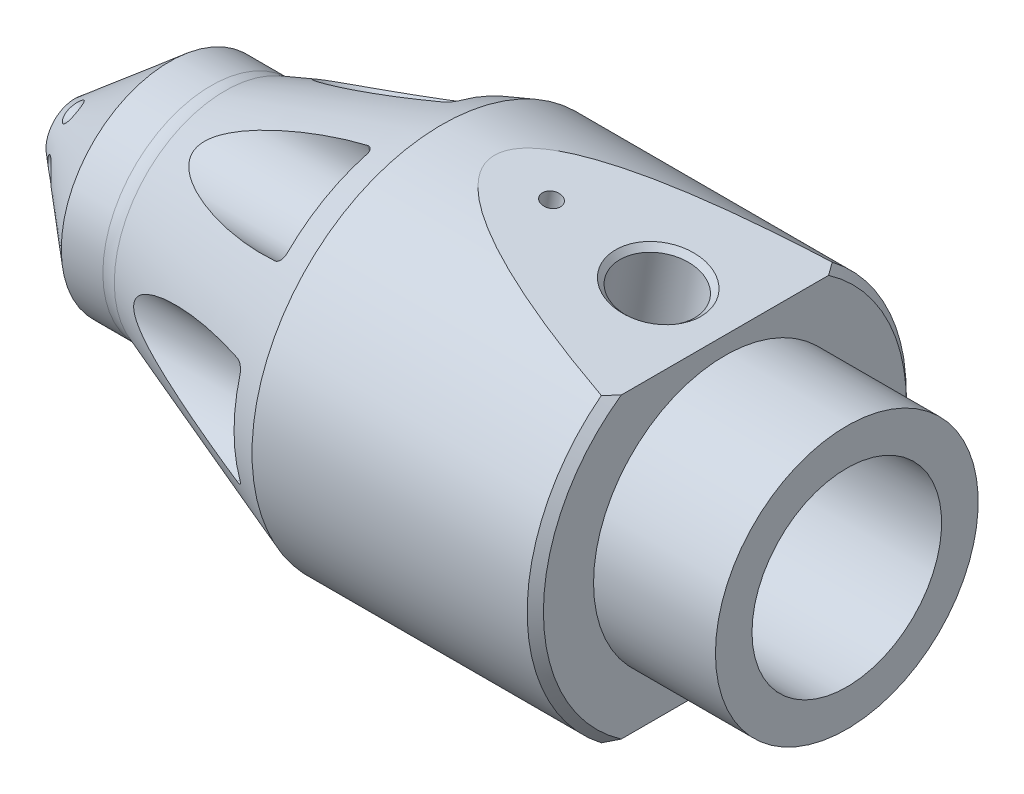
SolidWorks part; units mm, degrees
ref_plane "Front" through (0, 0, 0) normal (0, 0, 1) x (1, 0, 0)
ref_plane "Top" through (0, 0, 0) normal (0, 1, 0) x (1, 0, 0)
ref_plane "Right" through (0, 0, 0) normal (1, 0, 0) x (0, 0, -1)
sketch "Sketch1" plane through (0, 0, 0) normal (0, 0, 1) x (1, 0, 0)
  line L0 (0, 20) -> (0, 40) construction
  line L1 (0, 40) -> (18, 40)
  line L2 (18, 40) -> (100.4243, 70)
  line L3 (100.4243, 70) -> (205, 70)
  line L4 (205, 70) -> (205, 48.5)
  line L5 (205, 48.5) -> (250, 48.5)
  line L6 (250, 48.5) -> (250, 35)
  line L7 (0, 40) -> (-35, 10.6315)
  line L8 (0, 0) -> (240, 0) construction
  line L9 (250, 35) -> (145, 35)
  line L10 (145, 35) -> (119.0192, 20)
  line L11 (119.0192, 20) -> (0, 20)
  line L12 (-35, 10.6315) -> (-35, 5)
  line L13 (-35, 5) -> (-25.9808, 5)
  line L14 (-25.9808, 5) -> (0, 20)
  dimension "D1" = 80
  dimension "D2" = 140
  dimension "D3" = 97
  dimension "D4" = 40
  dimension "D5" = 45
  dimension "D6" = 20
  dimension "D7" = 18
  dimension "D8" = 70
  dimension "D9" = 105
  dimension "D10" = 30
  dimension "D11" = 250
  dimension "D12" = 10
  dimension "D13" = 35
  dimension "D14" = 30
  dimension "D15" = 40
revolve "Revolve1" add sketch "Sketch1" angle 360 about L8
sketch "Sketch2" plane through (0, 0, 0) normal (0, 0, 1) x (1, 0, 0)
  line L0 (205, 55) -> (119.9308, 70)
  line L1 (205, -70) -> (205, 70) construction
  line L2 (205, 70) -> (100.4243, 70) construction
  line L3 (205, 55) -> (205, 70)
  line L4 (205, 70) -> (119.9308, 70)
  dimension "D1" = 15
  dimension "D2" = 10
extrude "Cut-Extrude1" cut sketch "Sketch2" against normal through all both and the other way through all
sketch "Sketch4" plane through (15.5871, 88.3986, 0) normal (0.1736, 0.9848, 0) x (0.9848, -0.1736, 0)
  line L0 (192.3349, 43.3013) -> (192.3349, -43.3013) construction
  circle A0 centre (167.3349, 0) radius 14
  dimension "D1" = 28
  dimension "D2" = 25
extrude "Cut-Extrude2" cut sketch "Sketch4" against normal up to next
chamfer "Chamfer1" distance 2 angle 45 1 edges at (166.5925, 61.7723, 0)
hole_wizard "M8 Tapped Hole1" positions "Sketch5" profile "Sketch6" tap size "M8" standard "ISO"
sketch "Sketch5" plane through (15.5871, 88.3986, 0) normal (0.1736, 0.9848, 0) x (0.9848, -0.1736, 0)
  circle A0 centre (167.3349, 0) radius 14 construction
  point P0 (127.3349, 0)
  dimension "D1" = 40
sketch "Sketch6" plane through (140.9875, 66.2871, 0) normal (0, 0, 1) x (-0.9848, 0.1736, 0)
  line L0 (0, 0) -> (0, 24.2929)
  line L1 (0, 24.2929) -> (3.4, 22.25)
  line L2 (3.4, 22.25) -> (3.4, 0)
  line L5 (3.4, 0) -> (0, 0)
  line L10 (0, 24.2929) -> (-3.4, 22.25) construction
  line L11 (0, -6.35) -> (0, 107.95) construction
  dimension "Tap Drill Dia." = 6.8
  dimension "Tap Drill Depth" = 22.25
  dimension "Drill Angle" = 118
pattern_circular "CirPattern1" count 2 over 360 about axis through (0, 0, 0) along (-1, 0, 0) of "M8 Tapped Hole1", "Cut-Extrude2", "Cut-Extrude1", "Chamfer1"
chamfer "Chamfer2" distance 3 angle 45 4 edges at (205, 55, 0) (205, -55, 0) (205, 0, 70) (205, 0, -70)
fillet "Fillet1" radius 15 1 edges at (18, 0, 40)
sketch "Sketch8" plane through (0, 0, 0) normal (1, 0, 0) x (0, 0, -1)
  circle A0 centre (-65, 0) radius 20
  circle A1 centre (0, 0) radius 65 construction
  dimension "D1" = 130
  dimension "D2" = 40
extrude "Cut-Extrude4" cut sketch "Sketch8" along normal blind 90
fillet "Fillet3" radius 3 1 edges at (90, 0, 45)
pattern_circular "CirPattern2" count 6 over 360 about axis through (0, 0, 0) along (1, 0, 0) of "Cut-Extrude4", "Fillet3"
sketch "Sketch9" plane through (0, 0, 0) normal (0, 1, 0) x (1, 0, 0)
  line L0 (97.6768, 69) -> (204, 69)
  line L1 (204, 69) -> (204, 70)
  line L2 (202, 70) -> (100.4243, 70) construction
  line L3 (205, 38.2623) -> (205, 67) construction
  line L4 (100.4243, -70) -> (90, -66.2059)
  line L5 (31.7374, -45) -> (20.4854, -40.9046)
  line L6 (20.4854, 40.9046) -> (31.7374, 45)
  line L7 (90, 66.2059) -> (100.4243, 70)
  line L8 (90, 66.2059) -> (100.4243, 70) construction
  dimension "D1" = 1
  dimension "D2" = 1
extrude "Cut-Extrude5" cut sketch "Sketch9" against normal through all both and the other way through all
hole_wizard "M6 Tapped Hole1" positions "Sketch10" profile "Sketch11" tap size "M6" standard "ISO"
sketch "Sketch10" plane through (0, 0, -69) normal (0, 0, -1) x (-1, 0, 0)
  line L0 (-160, 0) -> (-110, 0) construction
  line L1 (-110, 0) -> (0, 0) construction
  point P0 (-110, 0)
  point P2 (-160, 0)
  dimension "D1" = 110
  dimension "D2" = 50
sketch "Sketch11" plane through (110, 0, -69) normal (1, 0, 0) x (0, 1, 0)
  line L0 (0, 0) -> (0, 16.5022)
  line L1 (0, 16.5022) -> (2.5, 15)
  line L2 (2.5, 15) -> (2.5, 0)
  line L5 (2.5, 0) -> (0, 0)
  line L10 (0, 16.5022) -> (-2.5, 15) construction
  line L11 (0, -6.35) -> (0, 107.95) construction
  dimension "Tap Drill Dia." = 5
  dimension "Tap Drill Depth" = 15
  dimension "Drill Angle" = 118
ref_plane "Plane1" through (-19.6962, 0, -23.473) normal (-0.6428, 0, -0.766) x (-0.766, 0, 0.6428)
hole_wizard "CSK for M4 Hex Socket Countersunk Cap Screw1" positions "Sketch12" profile "Sketch13" countersink size "M4" standard "ISO"
sketch "Sketch12" plane through (-19.6962, 0, -23.473) normal (-0.6428, 0, -0.766) x (-0.766, 0, 0.6428)
  line L0 (0, 0) -> (10, 0) construction
  point P0 (10, 0)
  dimension "D1" = 10
sketch "Sketch13" plane through (-27.3566, 0, -17.0451) normal (0, 1, 0) x (-0.766, 0, 0.6428)
  line L0 (0, 0) -> (0, 76.184)
  line L1 (0, 76.184) -> (2.25, 76.184)
  line L2 (2.25, 76.184) -> (2.25, 2.23)
  line L3 (2.25, 2.23) -> (4.48, 0)
  line L5 (4.48, 0) -> (0, 0)
  line L6 (-2.25, 2.23) -> (-4.48, 0) construction
  line L11 (0, -6.35) -> (0, 107.95) construction
  dimension "Thru Hole Dia." = 4.5
  dimension "Thru Hole Depth" = 76.184
  dimension "Near C'Sink Dia." = 8.96
  dimension "Near C'Sink Angle" = 90
pattern_circular "CirPattern3" count 6 over 360 about axis through (-35, 0, 0) along (-1, 0, 0) of "CSK for M4 Hex Socket Countersunk Cap Screw1"
